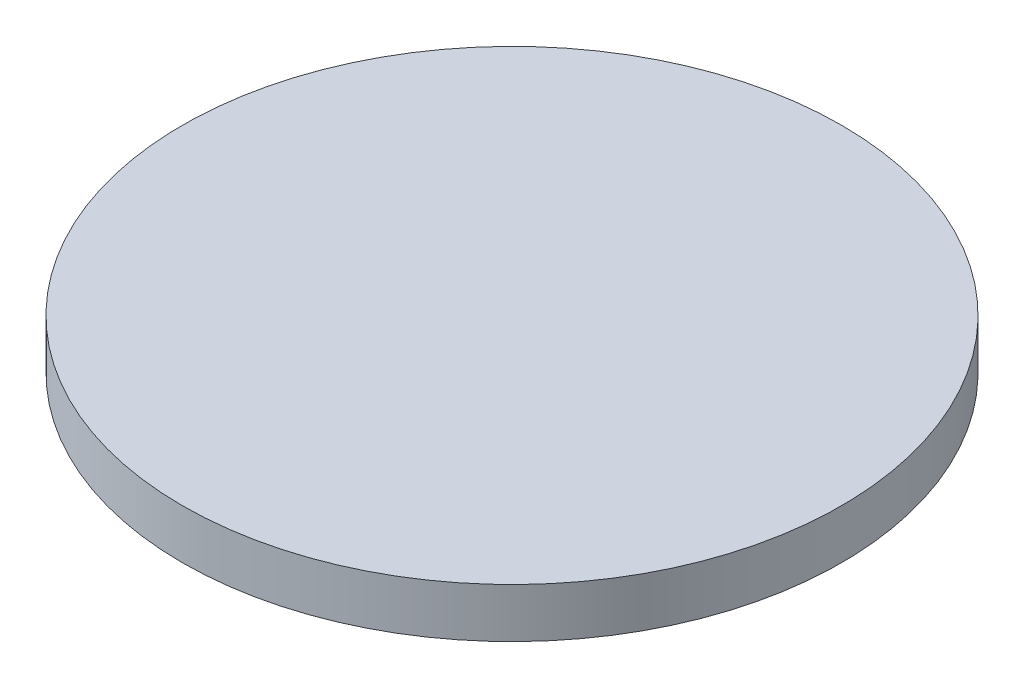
SolidWorks part; units mm, degrees
ref_plane "Front Plane" through (0, 0, 0) normal (0, 0, 1) x (1, 0, 0)
ref_plane "Top Plane" through (0, 0, 0) normal (0, 1, 0) x (1, 0, 0)
ref_plane "Right Plane" through (0, 0, 0) normal (1, 0, 0) x (0, 0, -1)
sketch "Sketch1" plane through (0, 0, 0) normal (0, 1, 0) x (1, 0, 0)
  circle A0 centre (0, 0) radius 20
  dimension "D1" = 40
extrude "Boss-Extrude1" add sketch "Sketch1" along normal blind 3
